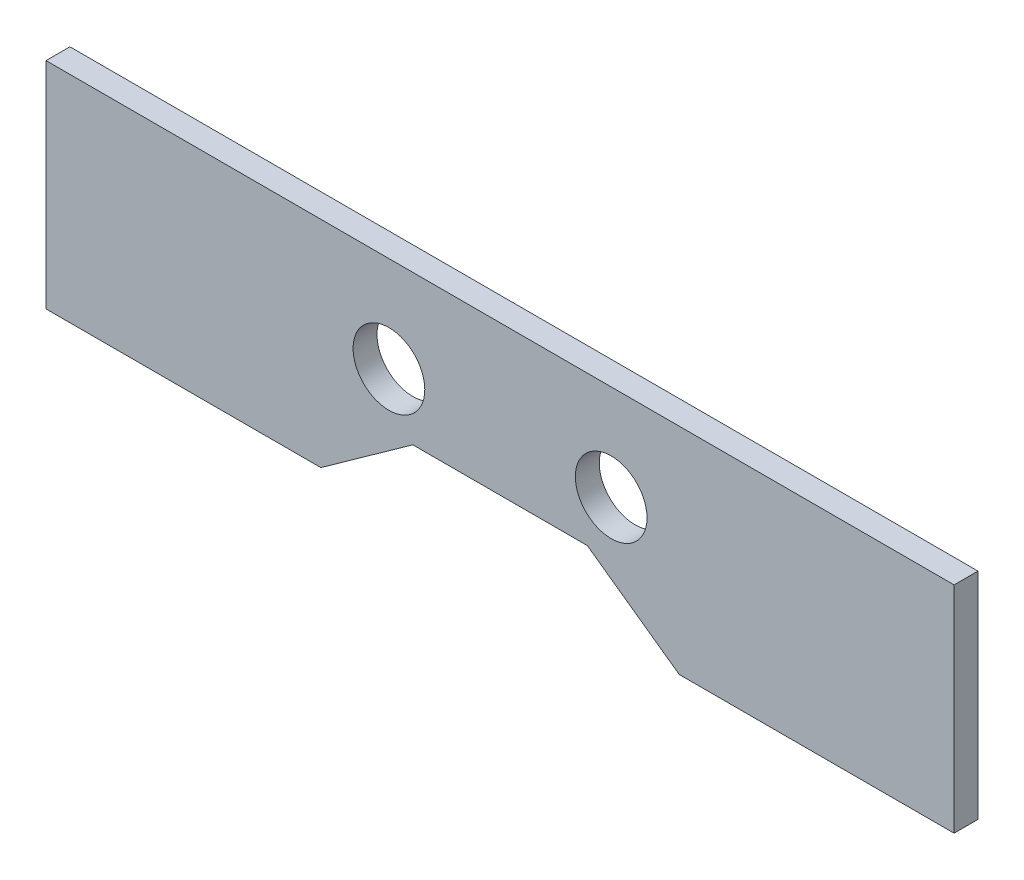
SolidWorks part; units mm, degrees
ref_plane "Front Plane" through (0, 0, 0) normal (0, 0, 1) x (1, 0, 0)
ref_plane "Top Plane" through (0, 0, 0) normal (0, 1, 0) x (1, 0, 0)
ref_plane "Right Plane" through (0, 0, 0) normal (1, 0, 0) x (0, 0, -1)
sketch "Sketch1" plane through (0, 0, 0) normal (0, 0, 1) x (1, 0, 0)
  line L0 (-482.6, 107.4674) -> (482.6, 107.4674)
  line L2 (-482.6, 107.4674) -> (-482.6, -121.1326)
  line L3 (-482.6, -121.1326) -> (482.6, -121.1326)
  line L4 (482.6, 107.4674) -> (482.6, -121.1326)
  circle A2 centre (118.11, 5.8674) radius 38.1
  circle A3 centre (-118.11, 5.8674) radius 38.1
  dimension "D3" = 228.6
  dimension "D4" = 127
  dimension "D5" = 76.2
  dimension "D6" = 76.2
  dimension "D11" = 364.49
  dimension "D2" = 965.2
  dimension "D7" = 482.6
  dimension "D8" = 236.22
  dimension "D9" = 121.1326
extrude "Extrude1" add sketch "Sketch1" along normal blind 25.4
sketch "Sketch2" plane through (0, 0, 25.4) normal (0, 0, 1) x (1, 0, 0)
  line L0 (-190.5, -121.1326) -> (-92.71, -51.2826)
  line L1 (-482.6, -121.1326) -> (482.6, -121.1326) construction
  line L2 (-92.71, -51.2826) -> (92.71, -51.2826)
  line L3 (92.71, -51.2826) -> (190.5, -121.1326)
  line L4 (482.6, -121.1326) -> (482.6, 107.4674) construction
  line L5 (-482.6, 107.4674) -> (-482.6, -121.1326) construction
  line L6 (-190.5, -121.1326) -> (190.5, -121.1326)
  circle A0 centre (118.11, 5.8674) radius 38.1 construction
  circle A1 centre (-118.11, 5.8674) radius 38.1 construction
  dimension "D1" = 57.15
  dimension "D2" = 25.4
  dimension "D3" = 25.4
  dimension "D4" = 292.1
  dimension "D5" = 292.1
extrude "Cut-Extrude1" cut sketch "Sketch2" against normal through all
